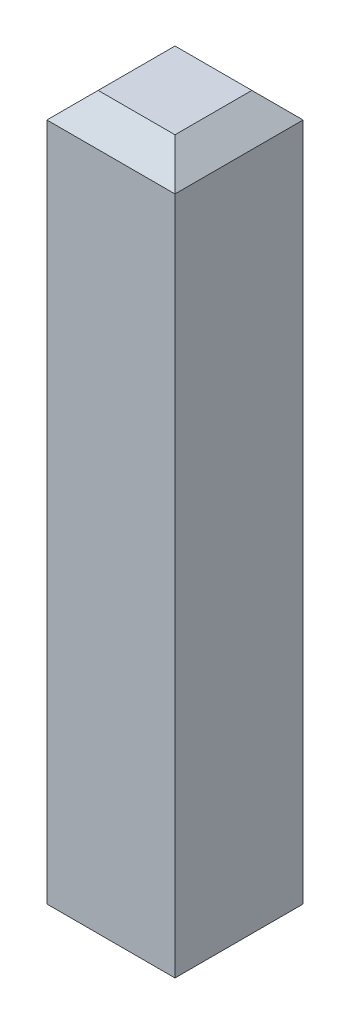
SolidWorks part; units mm, degrees
ref_plane "Front Plane" through (0, 0, 0) normal (0, 0, 1) x (1, 0, 0)
ref_plane "Top Plane" through (0, 0, 0) normal (0, 1, 0) x (1, 0, 0)
ref_plane "Right Plane" through (0, 0, 0) normal (1, 0, 0) x (0, 0, -1)
sketch "Sketch1" plane through (0, 0, 0) normal (0, 1, 0) x (1, 0, 0)
  line L1 (-0.25, 0.25) -> (0.25, 0.25)
  line L2 (-0.25, 0.25) -> (-0.25, -0.25)
  line L3 (-0.25, -0.25) -> (0.25, -0.25)
  line L4 (0.25, 0.25) -> (0.25, -0.25)
  point P4 (0, 0.25)
  point P6 (-0.25, 0)
  dimension "D1" = 0.5
  dimension "D2" = 0.5
extrude "Boss-Extrude1" add sketch "Sketch1" along normal blind 2.75
chamfer "Chamfer1" distance 0.1 angle 45 4 edges at (0, 2.75, -0.25) (-0.25, 2.75, 0) (0, 2.75, 0.25) (0.25, 2.75, 0)
